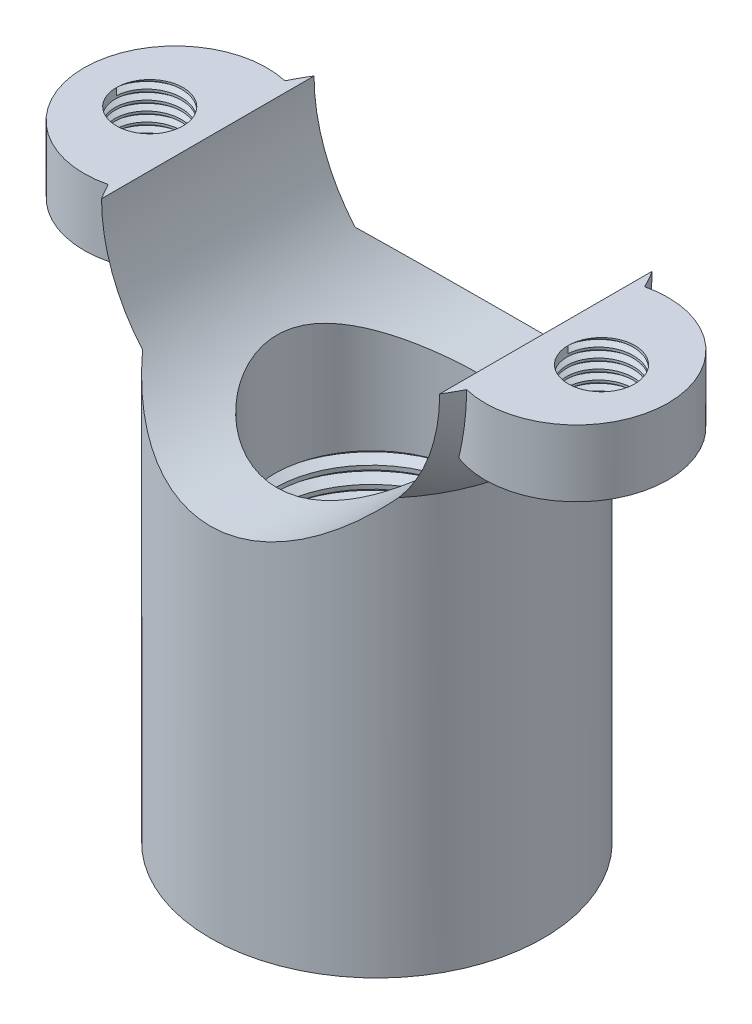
SolidWorks part; units mm, degrees
ref_plane "Front Plane" through (0, 0, 0) normal (0, 0, 1) x (1, 0, 0)
ref_plane "Top Plane" through (0, 0, 0) normal (0, 1, 0) x (1, 0, 0)
ref_plane "Right Plane" through (0, 0, 0) normal (1, 0, 0) x (0, 0, -1)
sketch "Sketch2" plane through (0, 0, 0) normal (0, 0, 1) x (1, 0, 0)
  line L0 (0, 19.05) -> (0, -19.05)
  arc A0 (0, 19.05) -> (0, -19.05) centre (0, 0) cw
  point P4 (0, 0)
  dimension "D1" = 38.1
revolve "Revolve1" add sketch "Sketch2" angle 360 about L0
sketch "Sketch3" plane through (0, 0, 0) normal (0, 1, 0) x (1, 0, 0)
  circle A0 centre (0, 0) radius 15.875
  dimension "D1" = 31.75
extrude "Boss-Extrude1" add sketch "Sketch3" against normal blind 50.165
sketch "Sketch4" plane through (0, 0, 0) normal (0, 0, 1) x (1, 0, 0)
  line L1 (-19.05, 0) -> (19.05, 0)
  line L2 (-19.05, 0) -> (-19.05, 19.05)
  line L3 (-19.05, 19.05) -> (19.05, 19.05)
  line L4 (19.05, 0) -> (19.05, 19.05)
  line L5 (-19.05, 0) -> (19.05, 19.05) construction
  line L6 (-19.05, 19.05) -> (19.05, 0) construction
  arc A0 (15.875, -10.5303) -> (-15.875, -10.5303) centre (0, 0) ccw construction
  point P4 (0, 9.525)
  dimension "D1" = 9.525
extrude "Cut-Extrude1" cut sketch "Sketch4" against normal mid plane 38.1
sketch "Sketch8" plane through (0, 0, 0) normal (0, 1, 0) x (1, 0, 0)
  circle A0 centre (19.05, 0) radius 8.7312
  circle A1 centre (0, 0) radius 19.05 construction
  circle A2 centre (-19.0493, -0.1623) radius 8.7312
  circle A3 centre (0, 0) radius 19.05 construction
  dimension "D1" = 17.4625
  dimension "D2" = 17.4625
  dimension "D3" = 19.0493
extrude "Boss-Extrude3" add sketch "Sketch8" against normal blind 6.35
sketch "Sketch5" plane through (0, 0, 0) normal (0, 0, 1) x (1, 0, 0)
  line L0 (19.05, 0) -> (-19.05, 0) construction
  circle A0 centre (0, 0) radius 16.129
  dimension "D1" = 32.258
extrude "Cut-Extrude2" cut sketch "Sketch5" against normal mid plane 38.1
ref_plane "Plane2" through (0, -50.165, 0) normal (0, -1, 0) x (-1, 0, 0)
sketch "Sketch9" plane through (0, -50.165, 0) normal (0, -1, 0) x (-1, 0, 0)
  circle A0 centre (0, 0) radius 9.525
  dimension "D1" = 19.05
sketch "Sketch12" plane through (0, 0, 0) normal (0, 1, 0) x (1, 0, 0)
  line L0 (-27.7802, -0.2367) -> (-21.4302, -0.2367) construction
  line L1 (27.7812, 0) -> (21.4312, 0) construction
  arc A0 (-17.1209, 8.3533) -> (-16.9761, -8.6438) centre (-19.0493, -0.1623) ccw construction
  arc A1 (17.0491, -8.4989) -> (17.0491, 8.4989) centre (19.05, 0) ccw construction
  circle A2 centre (-21.4302, -0.2367) radius 3.175
  circle A3 centre (21.4312, 0) radius 3.175
  point P16 (21.4312, 0)
  dimension "D1" = 6.35
  dimension "D2" = 6.35
  dimension "D3" = 6.35
extrude "Cut-Extrude3" cut sketch "Sketch9" against normal blind 50.165 contours A0
extrude "Cut-Extrude6" cut sketch "Sketch12" against normal blind 17.78 contours A2 | A3
thread "Thread1" pitch 1.5875 start angle 0, offset 0, length 25.4, pitch 1.5875, diameter 19.05
ref_plane "Plane3" through (9.525, -50.165, 0) normal (0, 0, 1) x (1, 0, 0)
sketch "Thread Profile1" plane through (9.525, -50.165, 0) normal (0, 0, 1) x (1, 0, 0)
  line L0 (0, 0) -> (0, 1.5875) construction
  line L1 (0, 0) -> (0.8593, 0.4961)
  line L2 (0.8593, 0.4961) -> (0.8593, 0.6945)
  line L3 (0.8593, 0.6945) -> (0, 1.1906)
  line L4 (0.8593, 0.5953) -> (0, 0.5953) construction
  line L11 (0, 0) -> (0, 1.1906)
  point P2 (0, 0)
  dimension "Pitch" = 1.5875
  dimension "Profile_Angle" = 60
  dimension "Profile_Land" = 0.1984
  dimension "Profile_Height" = 0.8593
thread "Thread2" pitch 0.9071 start angle 0, offset 0, length 6.35, pitch 0.9071, diameter 6.35
ref_plane "Plane4" through (18.2562, 0, 0) normal (0, 0, 1) x (-1, 0, 0)
sketch "Thread Profile2" plane through (18.2562, 0, 0) normal (0, 0, 1) x (-1, 0, 0)
  line L0 (0, 0) -> (0, 0.9071) construction
  line L1 (0, 0) -> (0.491, 0.2835)
  line L2 (0.491, 0.2835) -> (0.491, 0.3969)
  line L3 (0.491, 0.3969) -> (0, 0.6804)
  line L4 (0.491, 0.3402) -> (0, 0.3402) construction
  line L11 (0, 0) -> (0, 0.6804)
  point P2 (0, 0)
  dimension "Pitch" = 0.9071
  dimension "Profile_Angle" = 60
  dimension "Profile_Land" = 0.1134
  dimension "Profile_Height" = 0.491
thread "Thread3" pitch 0.9071 start angle 0, offset 0, length 6.35, pitch 0.9071, diameter 6.35
ref_plane "Plane6" through (-24.6052, 0, 0.2367) normal (0, 0, 1) x (-1, 0, 0)
sketch "Thread Profile4" plane through (-24.6052, 0, 0.2367) normal (0, 0, 1) x (-1, 0, 0)
  line L0 (0, 0) -> (0, 0.9071) construction
  line L1 (0, 0) -> (0.491, 0.2835)
  line L2 (0.491, 0.2835) -> (0.491, 0.3969)
  line L3 (0.491, 0.3969) -> (0, 0.6804)
  line L4 (0.491, 0.3402) -> (0, 0.3402) construction
  line L11 (0, 0) -> (0, 0.6804)
  point P2 (0, 0)
  dimension "Pitch" = 0.9071
  dimension "Profile_Angle" = 60
  dimension "Profile_Land" = 0.1134
  dimension "Profile_Height" = 0.491
